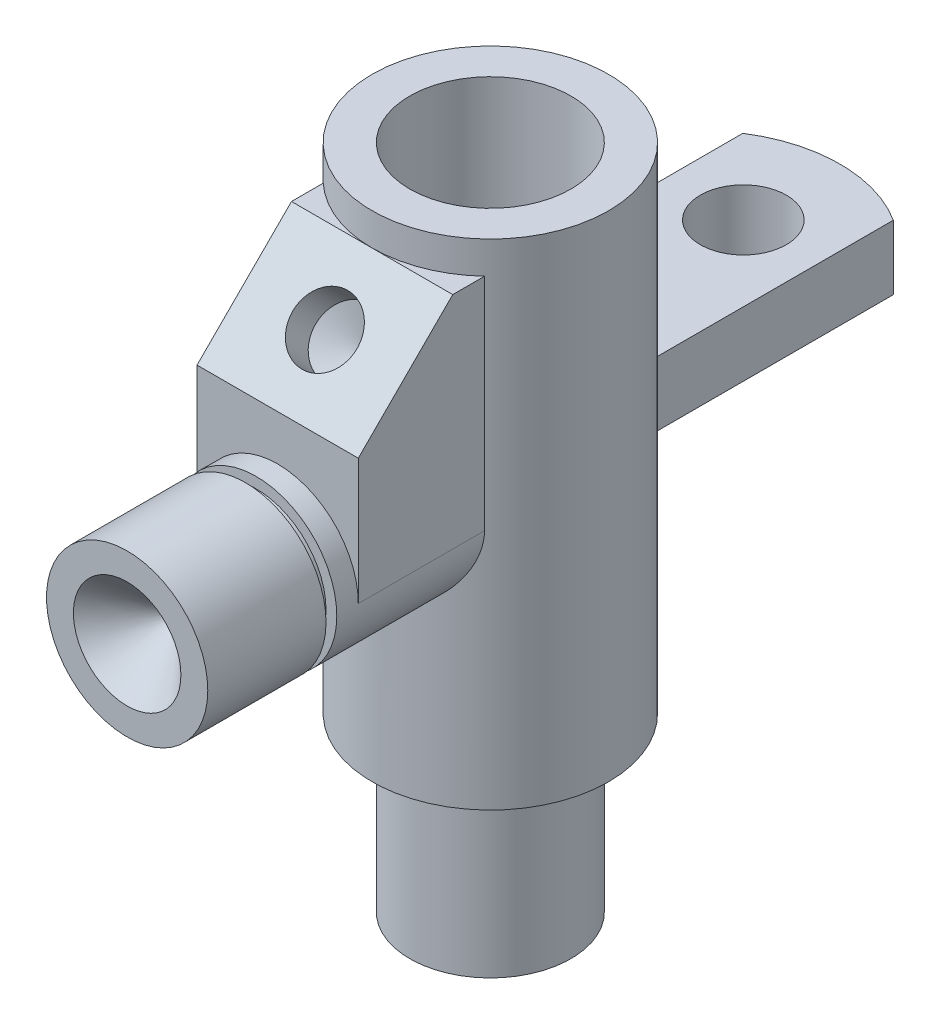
SolidWorks part; units mm, degrees
ref_plane "Front" through (0, 0, 0) normal (0, 0, 1) x (1, 0, 0)
ref_plane "Top" through (0, 0, 0) normal (0, 1, 0) x (1, 0, 0)
ref_plane "Right" through (0, 0, 0) normal (1, 0, 0) x (0, 0, -1)
sketch "Sketch1" plane through (0, 0, 0) normal (0, 0, 1) x (1, 0, 0)
  line L0 (0, 0) -> (0, -54.0553) construction
  line L1 (0, 0) -> (11, 0)
  line L2 (11, 0) -> (11, -46)
  line L3 (11, -46) -> (7.5, -46)
  line L4 (7.5, -46) -> (7.5, -62)
  line L5 (7.5, -62) -> (0, -62)
  line L6 (0, -62) -> (0, 0)
  dimension "D1" = 22
  dimension "D2" = 15
  dimension "D3" = 16
  dimension "D4" = 62
revolve "Revolve1" add sketch "Sketch1" angle 360 about L0
ref_plane "Plane1" through (0, -3, 0) normal (0, 1, 0) x (-1, 0, 0)
sketch "Sketch2" plane through (0, -3, 0) normal (0, 1, 0) x (-1, 0, 0)
  line L0 (0, 0) -> (0, 21.5554) construction
  line L1 (-7.5, 8.0467) -> (-7.5, 19.7853)
  line L2 (-7.5, 19.7853) -> (7.5, 19.7853)
  line L3 (7.5, 8.0467) -> (7.5, 19.7853)
  circle A0 centre (0, 0) radius 11 construction
  arc A1 (7.5, 8.0467) -> (-7.5, 8.0467) centre (0, 0) ccw
  point P8 (0, 19.7853)
  dimension "D1" = 15
extrude "Extrude1" add sketch "Sketch2" against normal offset from surface (20.5 mm away) 22.5
sketch "Sketch3" plane through (0, 0, 0) normal (1, 0, 0) x (0, 0, -1)
  line L0 (-11, -3) -> (-19.7853, -11.7853)
  line L2 (-19.7853, -23.5) -> (-19.7853, -3) construction
  line L3 (-19.7853, -11.7853) -> (-19.7853, -3)
  line L4 (-19.7853, -3) -> (-11, -3)
extrude "Cut-Extrude1" cut sketch "Sketch3" against normal through all and the other way through all
sketch "Sketch5" plane through (0, 0, 19.7853) normal (0, 0, 1) x (1, 0, 0)
  line L0 (7.5, -23.5) -> (7.5, -11.7853) construction
  line L1 (-7.5, -23.5) -> (-7.5, -11.7853) construction
  line L3 (7.5, -23.5) -> (-7.5, -23.5) construction
  circle A0 centre (0, -23.5) radius 7.5
extrude "Extrude2" add sketch "Sketch5" along normal blind 14 and the other way up to surface
sketch "Sketch7" plane through (0, 0, 0) normal (1, 0, 0) x (0, 0, -1)
  line L0 (-33.7853, -23.5) -> (-4.5, -23.5)
  line L1 (-33.7853, -16) -> (-33.7853, -31) construction
  line L2 (-4.5, -23.5) -> (-4.5, -62)
  line L3 (-7.5, -62) -> (7.5, -62) construction
  dimension "D1" = 4.5
sketch "Sketch8" plane through (0, 0, 33.7853) normal (0, 0, 1) x (1, 0, 0)
  circle A0 centre (0, -23.5) radius 0.625
  dimension "D1" = 1.25
sweep "Cut-Sweep1" cut profiles "Sketch8" path "Sketch7"
sketch "Sketch9" plane through (0, 0, 0) normal (1, 0, 0) x (0, 0, -1)
  line L0 (-33.7853, -23.5) -> (-21.716, -23.5) construction
  line L1 (-33.7853, -16) -> (-33.7853, -31) construction
  line L2 (-33.7853, -18.5) -> (-28.7853, -23.5)
  line L3 (-33.7853, -28.5) -> (-28.7853, -23.5) construction
  line L4 (-33.7853, -23.5) -> (-33.7853, -18.5)
  line L5 (-33.7853, -23.5) -> (-28.7853, -23.5)
  dimension "D1" = 10
  dimension "D2" = 90
revolve "Cut-Revolve1" cut sketch "Sketch9" angle 360 about L0
sketch "Sketch10" plane through (0, 0, 0) normal (1, 0, 0) x (0, 0, -1)
  line L0 (0, 0) -> (0, -62) construction
  line L1 (0, 0) -> (5.8328, 0)
  line L2 (11, 0) -> (-11, 0) construction
  line L3 (7.5, -8.2989) -> (7.5, 0)
  line L4 (7.5, 0) -> (5.8328, 0)
  line L5 (7.5, -8.2989) -> (7.5, -16.25)
  line L6 (7.5, -16.25) -> (2.5, -16.25)
  line L7 (2.5, -16.25) -> (2.5, -62)
  line L8 (-7.5, -62) -> (7.5, -62) construction
  line L9 (2.5, -62) -> (0, -62)
  line L10 (0, -62) -> (0, 0)
  dimension "D1" = 15
  dimension "D2" = 16.25
  dimension "D3" = 5
revolve "Cut-Revolve2" cut sketch "Sketch10" angle 360 about L0
ref_plane "Plane2" through (0, -24, 0) normal (0, -1, 0) x (1, 0, 0)
sketch "Sketch11" plane through (0, -24, 0) normal (0, -1, 0) x (1, 0, 0)
  line L0 (0, 0) -> (0, -18.6374) construction
  line L1 (-7, -8.4853) -> (-7, -30.4833)
  line L2 (7, -8.4853) -> (7, -30.4833)
  circle A0 centre (0, 0) radius 11 construction
  arc A1 (-7, -8.4853) -> (7, -8.4853) centre (0, 0) ccw
  arc A2 (-7, -30.4833) -> (7, -30.4833) centre (0, -19.5289) ccw
  dimension "D1" = 13
  dimension "D3" = 14
extrude "Extrude3" add sketch "Sketch11" against normal blind 6
sketch "Sketch12" plane through (0, -18, 0) normal (0, 1, 0) x (-1, 0, 0)
  arc A0 (-7, -30.4833) -> (7, -30.4833) centre (0, -19.5289) ccw construction
  point P0 (0, -23.5289)
  dimension "D1" = 9
other "Hole1"
sketch "Sketch13" plane through (0, -18, 0) normal (0, 1, 0) x (-1, 0, 0)
  circle A0 centre (0, -23.5289) radius 4
  dimension "D1" = 8
sketch "Sketch14" plane through (0, 0, 0) normal (1, 0, 0) x (0, 0, -1)
  line L0 (-15.3927, -7.3927) -> (-4.4901, -18.2953) construction
  line L1 (-19.7853, -11.7853) -> (-11, -3) construction
  line L2 (-13.2714, -5.2714) -> (-11.15, -7.3927)
  line L3 (-11.15, -7.3927) -> (-11.15, -10.7514)
  line L4 (-11.15, -10.7514) -> (-7.5, -14.4015)
  line L5 (-7.5, 0) -> (-7.5, -16.25) construction
  line L6 (-7.5, -14.4015) -> (-6.5757, -15.3257)
  line L7 (-6.5757, -15.3257) -> (-7.0177, -15.7677)
  line L8 (-7.0177, -15.7677) -> (-15.3927, -7.3927)
  line L9 (-15.3927, -7.3927) -> (-13.2714, -5.2714)
  dimension "D1" = 6
  dimension "D2" = 45
  dimension "D3" = 1.25
  dimension "D4" = 3
revolve "Cut-Revolve3" cut sketch "Sketch14" angle 360 about L0
sketch "Sketch15" plane through (0, 0, 0) normal (1, 0, 0) x (0, 0, -1)
  line L0 (-33.7853, -23.5) -> (37.6217, -23.5) construction
  line L1 (-33.7853, -16) -> (-33.7853, -31) construction
  line L2 (-19.7853, -16) -> (-33.7853, -16) construction
  line L3 (-22.7853, -16) -> (-21.7853, -16)
  line L4 (-22.7853, -16) -> (-22.7853, -17)
  line L5 (-22.7853, -17) -> (-21.7853, -17)
  line L6 (-21.7853, -16) -> (-21.7853, -17)
  dimension "D1" = 11
  dimension "D2" = 1
  dimension "D3" = 1
revolve "Cut-Revolve4" cut sketch "Sketch15" angle 360 about L0
